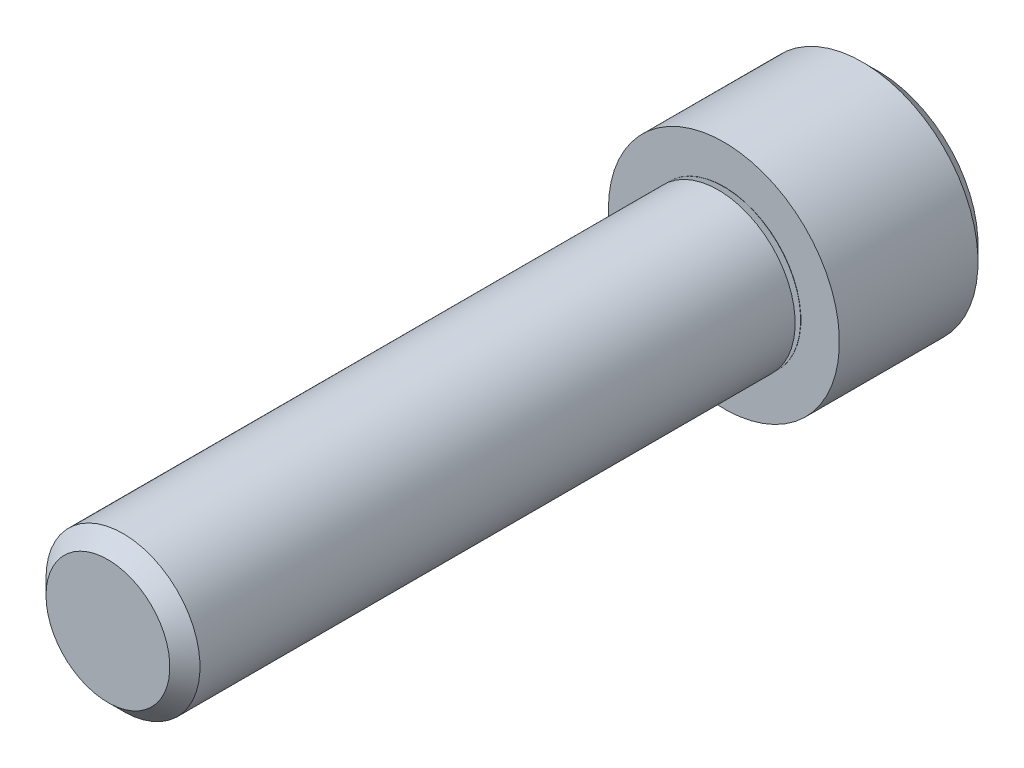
SolidWorks part; units mm, degrees
ref_plane "Front" through (0, 0, 0) normal (0, 0, 1) x (1, 0, 0)
ref_plane "Top" through (0, 0, 0) normal (0, 1, 0) x (1, 0, 0)
ref_plane "Right" through (0, 0, 0) normal (1, 0, 0) x (0, 0, -1)
sketch "Logo3_Revol_Axis" plane through (0, 0, 0) normal (0, 1, 0) x (1, 0, 0)
  line L0 (0, -43.5172) -> (0, 43.5172) construction
sketch "Logo3_bib1" plane through (0, 0, 0) normal (0, -1, 0) x (-1, 0, 0)
  line L0 (0, -25.4) -> (0, 6.35)
  line L1 (0, 6.35) -> (4.1275, 6.35)
  line L2 (4.7625, 5.715) -> (4.7625, 0)
  line L3 (4.7625, 0) -> (3.175, 0)
  line L4 (3.175, 0) -> (3.175, -0.01)
  line L5 (3.175, -24.7777) -> (2.5527, -25.4)
  line L6 (2.5527, -25.4) -> (0, -25.4)
  line L7 (3.175, -0.01) -> (2.6661, -0.01)
  line L8 (2.6593, -0.0488) -> (3.175, -0.2365)
  line L9 (3.175, -0.2365) -> (3.175, -24.7777)
  line L10 (0, 10.5852) -> (0, -63.2873) construction
  line L11 (4.1275, 6.35) -> (4.7625, 5.715)
  arc A1 (2.6661, -0.01) -> (2.6593, -0.0488) centre (2.6661, -0.03) ccw
  point P17 (2.5527, -0.01)
  point P19 (4.7625, 6.35)
revolve "Revolve1" add sketch "Logo3_bib1" angle 360 about L10
sketch "Logo3_bib2" plane through (0, 0, -6.35) normal (0, 0, -1) x (1, 0, 0)
  line L1 (2.7496, 0) -> (1.3748, 2.3813)
  line L2 (1.3748, 2.3813) -> (-1.3748, 2.3813)
  line L3 (-1.3748, 2.3813) -> (-2.7496, 0)
  line L4 (-2.7496, 0) -> (-1.3748, -2.3813)
  line L5 (-1.3748, -2.3813) -> (1.3748, -2.3813)
  line L6 (1.3748, -2.3813) -> (2.7496, 0)
  circle A0 centre (0, 0) radius 2.3812 construction
  dimension "Logo3_c1" = 4.7625
extrude "Cut-Extrude1" cut sketch "Logo3_bib2" against normal blind 3.175
equation "\"DIA2@Logo3_bib1\" = \"Logo3_d1-pas@Logo3_bib1\""
equation "\"LGT1@Logo3_bib1\" = \"Logo3_d1@Logo3_bib1\""
equation "\"D1@Cut-Extrude1\" = \"Logo3_d1@Logo3_bib1\"/2."
equation "\"D2@Cosmetic Thread1\" = \"Logo3_d1-pas@Logo3_bib1\""
equation "\"D5@Logo3_bib1\"=\"Logo3_d1@Logo3_bib1\"*.1"
